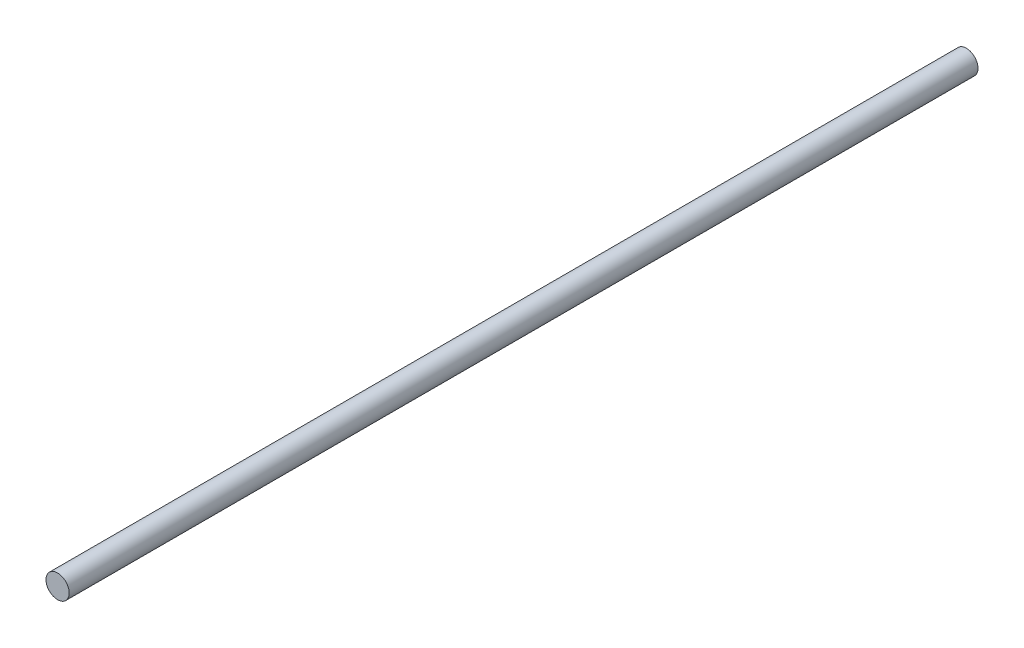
SolidWorks part; units mm, degrees
ref_plane "Front Plane" through (0, 0, 0) normal (0, 0, 1) x (1, 0, 0)
ref_plane "Top Plane" through (0, 0, 0) normal (0, 1, 0) x (1, 0, 0)
ref_plane "Right Plane" through (0, 0, 0) normal (1, 0, 0) x (0, 0, -1)
sketch "Sketch1" plane through (0, 0, 0) normal (0, 0, 1) x (1, 0, 0)
  circle A0 centre (0, 0) radius 30
  dimension "D1" = 60
extrude "Boss-Extrude1" add sketch "Sketch1" against normal blind 2350
